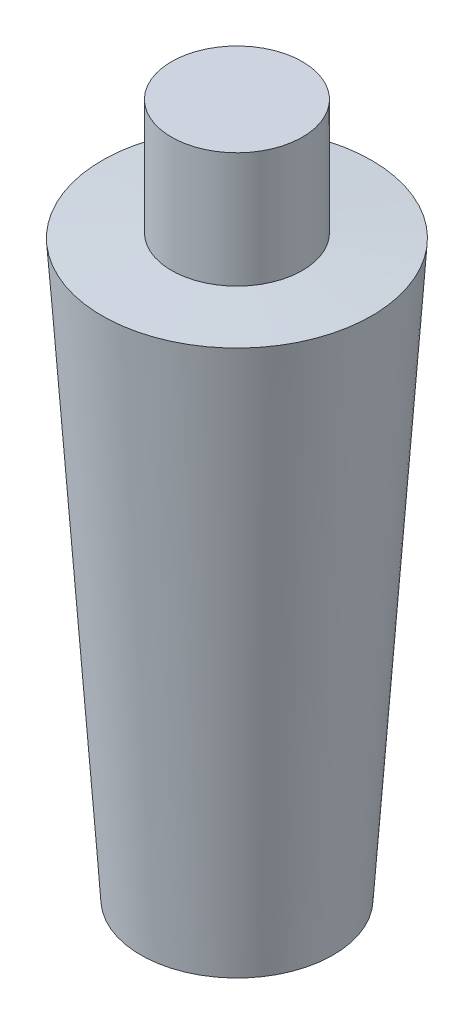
SolidWorks part; units mm, degrees
ref_plane "Plan de face" through (0, 0, 0) normal (0, 0, 1) x (1, 0, 0)
ref_plane "Plan de dessus" through (0, 0, 0) normal (0, 1, 0) x (1, 0, 0)
ref_plane "Plan de droite" through (0, 0, 0) normal (1, 0, 0) x (0, 0, -1)
sketch "Esquisse1" plane through (0, 0, 0) normal (0, 0, 1) x (1, 0, 0)
  line L0 (0, 0) -> (0, 1200.7629) construction
  line L1 (0, 0) -> (-250, 0)
  line L2 (-250, 0) -> (-350, 1487.9024)
  line L3 (-350, 1487.9024) -> (-170, 1500)
  line L4 (-170, 1500) -> (-170, 1800)
  line L5 (-170, 1800) -> (0, 1800)
  line L6 (0, 1800) -> (0, 0)
  dimension "D1" = 350
  dimension "D2" = 1800
  dimension "D3" = 1500
  dimension "D4" = 100
  dimension "D5" = 180
revolve "Révolution1" add sketch "Esquisse1" angle 360 about L0
